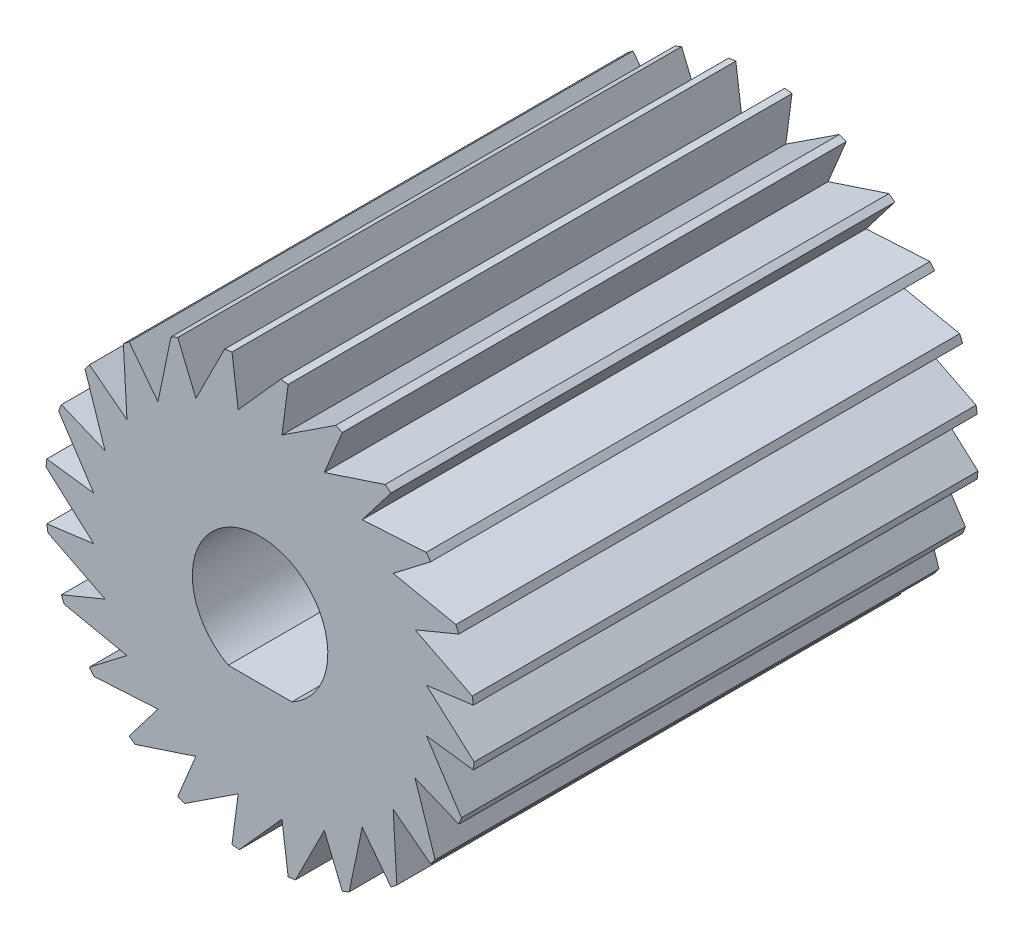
SolidWorks part; units mm, degrees
ref_plane "Front" through (0, 0, 0) normal (0, 0, 1) x (1, 0, 0)
ref_plane "Top" through (0, 0, 0) normal (0, 1, 0) x (1, 0, 0)
ref_plane "Right" through (0, 0, 0) normal (1, 0, 0) x (0, 0, -1)
sketch "Sketch1" plane through (0, 0, 0) normal (0, 0, 1) x (1, 0, 0)
  line L0 (-304.8, 0) -> (304.8, 0) construction
  circle A0 centre (0, 0) radius 12.7 construction
  circle A1 centre (0, 0) radius 13.335 construction
  circle A2 centre (0, 0) radius 4.7625
  circle A3 centre (0, 0) radius 9.906
  point P8 (0, 12.7)
  point P9 (0, -12.7)
extrude "Boss-Extrude1" add sketch "Sketch1" against normal blind 6.35
sketch "Sketch2" plane through (0, 0, 0) normal (0, 0, 1) x (1, 0, 0)
  line L0 (0, 0) -> (0, 12.7) construction
  line L1 (0, 0) -> (-1.293, 9.8213) construction
  line L2 (0, 0) -> (1.7406, 13.2209) construction
  line L3 (-1.293, 9.8213) -> (1.293, 9.8213) construction
  line L4 (-1.293, 9.8213) -> (1.7406, 13.2209)
  line L5 (1.7406, 13.2209) -> (1.293, 9.8213)
  circle A0 centre (0, 0) radius 12.7 construction
  circle A1 centre (0, 0) radius 13.335 construction
  circle A2 centre (0, 0) radius 9.906 construction
  arc A4 (1.293, 9.8213) -> (-1.293, 9.8213) centre (0, 0) ccw
  point P11 (0, 9.8213)
extrude "Boss-Extrude2" add sketch "Sketch2" against normal blind 6.35
pattern_circular "CirPattern1" count 24 over 360 about axis through (0, 0, 0) along (0, 0, 1) of "Boss-Extrude2"
chamfer "Chamfer1" distance 0.0953 angle 45 2 edges at (4.7625, 0, -6.35) (4.7625, 0, 0)
sketch "Pawl" plane through (0, 0, 0) normal (0, 0, 1) x (1, 0, 0)
  line L0 (1.6577, 12.5913) -> (4.4531, 11.8937) construction
  line L1 (1.293, 9.8213) -> (1.7406, 13.2209) construction
  line L2 (5.1031, 12.3199) -> (1.293, 9.8213) construction
  circle A0 centre (0, 0) radius 12.7 construction
  point P4 (3.0554, 12.2425)
  line B0 (3.0554, 13.0045) -> (3.0554, 12.2425)
  circle B1 centre (19.7242, 13.0363) radius 1.1906
  arc B2 (19.0678, 10.7473) -> (19.7242, 15.4175) centre (19.7242, 13.0363) ccw
  arc B3 (8.0376, 15.4175) -> (3.0554, 13.0045) centre (8.0376, 9.0675) ccw
  arc B4 (10.6187, 13.17) -> (3.8174, 12.2425) centre (7.9399, 7.4127) ccw
sketch_block_instance "Block1-1"
sketch_block "Block1"
sketch "Ref" plane through (0, 0, 0) normal (1, 0, 0) x (0, 0, -1)
  line L0 (0.0952, 4.7625) -> (6.2548, 4.7625) construction
  line L1 (6.2548, 4.7625) -> (6.35, 4.8578) construction
  line L2 (0.0952, 4.7625) -> (0, 4.8577) construction
  line L3 (0, -5.9543) -> (0.0952, -4.7625) construction
  line L4 (0, -8.1178) -> (0, -3.7909) construction
  line L5 (0.0952, -4.7625) -> (6.2548, -4.7625) construction
  line L6 (6.2548, -4.7625) -> (6.35, -4.8578) construction
sketch "Sketch3" plane through (0, 0, 0) normal (0, 0, 1) x (1, 0, 0)
  circle A0 centre (0, 0) radius 12.7 construction
  circle A1 centre (0, 0) radius 12.7
extrude "Cut-Extrude-Thin1" cut sketch "Sketch3" against normal through all flip side to cut thin
scale "Scale1" scale about centroid uniform scaling yes scale factor 0.4
sketch "Sketch4" plane through (0, 0, -1.905) normal (0, 0, 1) x (1, 0, 0)
  circle A0 centre (0, 0) radius 2.3829
extrude "Boss-Extrude3" add sketch "Sketch4" against normal up to surface (2.54 mm away)
sketch "Sketch6" plane through (0, 0, -1.905) normal (0, 0, 1) x (1, 0, 0)
  line L48 (3.9285, 0.5172) -> (5.0365, 0.6631)
  line L49 (5.0107, 0.8361) -> (3.6608, 1.5163)
  line L50 (3.6608, 1.5163) -> (4.6933, 1.944)
  line L51 (4.6236, 2.1045) -> (3.1436, 2.4122)
  line L52 (3.1436, 2.4122) -> (4.0302, 3.0925)
  line L53 (3.9213, 3.2295) -> (2.4122, 3.1436)
  line L54 (2.4122, 3.1436) -> (3.0925, 4.0302)
  line L55 (2.9519, 4.1343) -> (1.5163, 3.6608)
  line L56 (1.5163, 3.6608) -> (1.944, 4.6933)
  line L57 (1.7812, 4.7575) -> (0.5172, 3.9285)
  line L58 (0.5172, 3.9285) -> (0.6631, 5.0365)
  line L59 (0.4892, 5.0564) -> (-0.5172, 3.9285)
  line L60 (-0.5172, 3.9285) -> (-0.6631, 5.0365)
  line L61 (-0.8361, 5.0107) -> (-1.5163, 3.6608)
  line L62 (-1.5163, 3.6608) -> (-1.944, 4.6933)
  line L63 (-2.1045, 4.6236) -> (-2.4122, 3.1436)
  line L64 (-2.4122, 3.1436) -> (-3.0925, 4.0302)
  line L65 (-3.2295, 3.9213) -> (-3.1436, 2.4122)
  line L66 (-3.1436, 2.4122) -> (-4.0302, 3.0925)
  line L67 (-4.1343, 2.9519) -> (-3.6608, 1.5163)
  line L68 (-3.6608, 1.5163) -> (-4.6933, 1.944)
  line L69 (-4.7575, 1.7812) -> (-3.9285, 0.5172)
  line L70 (-3.9285, 0.5172) -> (-5.0365, 0.6631)
  line L71 (-5.0564, 0.4892) -> (-3.9285, -0.5172)
  line L72 (-3.9285, -0.5172) -> (-5.0365, -0.6631)
  line L73 (-5.0107, -0.8361) -> (-3.6608, -1.5163)
  line L74 (-3.6608, -1.5163) -> (-4.6933, -1.944)
  line L75 (-4.6236, -2.1045) -> (-3.1436, -2.4122)
  line L76 (-3.1436, -2.4122) -> (-4.0302, -3.0925)
  line L77 (-3.9213, -3.2295) -> (-2.4122, -3.1436)
  line L78 (-2.4122, -3.1436) -> (-3.0925, -4.0302)
  line L79 (-2.9519, -4.1343) -> (-1.5163, -3.6608)
  line L80 (-1.5163, -3.6608) -> (-1.944, -4.6933)
  line L81 (-1.7812, -4.7575) -> (-0.5172, -3.9285)
  line L82 (-0.5172, -3.9285) -> (-0.6631, -5.0365)
  line L83 (-0.4892, -5.0564) -> (0.5172, -3.9285)
  line L84 (0.5172, -3.9285) -> (0.6631, -5.0365)
  line L85 (0.8361, -5.0107) -> (1.5163, -3.6608)
  line L86 (1.5163, -3.6608) -> (1.944, -4.6933)
  line L87 (2.1045, -4.6236) -> (2.4122, -3.1436)
  line L88 (2.4122, -3.1436) -> (3.0925, -4.0302)
  line L89 (3.2295, -3.9213) -> (3.1436, -2.4122)
  line L90 (3.1436, -2.4122) -> (4.0302, -3.0925)
  line L91 (4.1343, -2.9519) -> (3.6608, -1.5163)
  line L92 (3.6608, -1.5163) -> (4.6933, -1.944)
  line L93 (4.7575, -1.7812) -> (3.9285, -0.5172)
  line L94 (3.9285, -0.5172) -> (5.0365, -0.6631)
  line L95 (5.0564, -0.4892) -> (3.9285, 0.5172)
  line L96 (3.9285, 0.5172) -> (5.0365, 0.6631)
  line L97 (5.0107, 0.8361) -> (3.6608, 1.5163)
  line L98 (3.6608, 1.5163) -> (4.6933, 1.944)
  line L99 (4.6236, 2.1045) -> (3.1436, 2.4122)
  line L100 (3.1436, 2.4122) -> (4.0302, 3.0925)
  line L101 (3.9213, 3.2295) -> (2.4122, 3.1436)
  line L102 (2.4122, 3.1436) -> (3.0925, 4.0302)
  line L103 (2.9519, 4.1343) -> (1.5163, 3.6608)
  line L104 (1.5163, 3.6608) -> (1.944, 4.6933)
  line L105 (1.7812, 4.7575) -> (0.5172, 3.9285)
  line L106 (0.5172, 3.9285) -> (0.6631, 5.0365)
  line L107 (0.4892, 5.0564) -> (-0.5172, 3.9285)
  line L108 (-0.5172, 3.9285) -> (-0.6631, 5.0365)
  line L109 (-0.8361, 5.0107) -> (-1.5163, 3.6608)
  line L110 (-1.5163, 3.6608) -> (-1.944, 4.6933)
  line L111 (-2.1045, 4.6236) -> (-2.4122, 3.1436)
  line L112 (-2.4122, 3.1436) -> (-3.0925, 4.0302)
  line L113 (-3.2295, 3.9213) -> (-3.1436, 2.4122)
  line L114 (-3.1436, 2.4122) -> (-4.0302, 3.0925)
  line L115 (-4.1343, 2.9519) -> (-3.6608, 1.5163)
  line L116 (-3.6608, 1.5163) -> (-4.6933, 1.944)
  line L117 (-4.7575, 1.7812) -> (-3.9285, 0.5172)
  line L118 (-3.9285, 0.5172) -> (-5.0365, 0.6631)
  line L119 (-5.0564, 0.4892) -> (-3.9285, -0.5172)
  line L120 (-3.9285, -0.5172) -> (-5.0365, -0.6631)
  line L121 (-5.0107, -0.8361) -> (-3.6608, -1.5163)
  line L122 (-3.6608, -1.5163) -> (-4.6933, -1.944)
  line L123 (-4.6236, -2.1045) -> (-3.1436, -2.4122)
  line L124 (-3.1436, -2.4122) -> (-4.0302, -3.0925)
  line L125 (-3.9213, -3.2295) -> (-2.4122, -3.1436)
  line L126 (-2.4122, -3.1436) -> (-3.0925, -4.0302)
  line L127 (-2.9519, -4.1343) -> (-1.5163, -3.6608)
  line L128 (-1.5163, -3.6608) -> (-1.944, -4.6933)
  line L129 (-1.7812, -4.7575) -> (-0.5172, -3.9285)
  line L130 (-0.5172, -3.9285) -> (-0.6631, -5.0365)
  line L131 (-0.4892, -5.0564) -> (0.5172, -3.9285)
  line L132 (0.5172, -3.9285) -> (0.6631, -5.0365)
  line L133 (0.8361, -5.0107) -> (1.5163, -3.6608)
  line L134 (1.5163, -3.6608) -> (1.944, -4.6933)
  line L135 (2.1045, -4.6236) -> (2.4122, -3.1436)
  line L136 (2.4122, -3.1436) -> (3.0925, -4.0302)
  line L137 (3.2295, -3.9213) -> (3.1436, -2.4122)
  line L138 (3.1436, -2.4122) -> (4.0302, -3.0925)
  line L139 (4.1343, -2.9519) -> (3.6608, -1.5163)
  line L140 (3.6608, -1.5163) -> (4.6933, -1.944)
  line L141 (4.7575, -1.7812) -> (3.9285, -0.5172)
  line L142 (3.9285, -0.5172) -> (5.0365, -0.6631)
  line L143 (5.0564, -0.4892) -> (3.9285, 0.5172)
  arc A24 (5.0365, 0.6631) -> (5.0107, 0.8361) centre (0, 0) ccw
  arc A25 (4.6933, 1.944) -> (4.6236, 2.1045) centre (0, 0) ccw
  arc A26 (4.0302, 3.0925) -> (3.9213, 3.2295) centre (0, 0) ccw
  arc A27 (3.0925, 4.0302) -> (2.9519, 4.1343) centre (0, 0) ccw
  arc A28 (1.944, 4.6933) -> (1.7812, 4.7575) centre (0, 0) ccw
  arc A29 (0.6631, 5.0365) -> (0.4892, 5.0564) centre (0, 0) ccw
  arc A30 (-0.6631, 5.0365) -> (-0.8361, 5.0107) centre (0, 0) ccw
  arc A31 (-1.944, 4.6933) -> (-2.1045, 4.6236) centre (0, 0) ccw
  arc A32 (-3.0925, 4.0302) -> (-3.2295, 3.9213) centre (0, 0) ccw
  arc A33 (-4.0302, 3.0925) -> (-4.1343, 2.9519) centre (0, 0) ccw
  arc A34 (-4.6933, 1.944) -> (-4.7575, 1.7812) centre (0, 0) ccw
  arc A35 (-5.0365, 0.6631) -> (-5.0564, 0.4892) centre (0, 0) ccw
  arc A36 (-5.0365, -0.6631) -> (-5.0107, -0.8361) centre (0, 0) ccw
  arc A37 (-4.6933, -1.944) -> (-4.6236, -2.1045) centre (0, 0) ccw
  arc A38 (-4.0302, -3.0925) -> (-3.9213, -3.2295) centre (0, 0) ccw
  arc A39 (-3.0925, -4.0302) -> (-2.9519, -4.1343) centre (0, 0) ccw
  arc A40 (-1.944, -4.6933) -> (-1.7812, -4.7575) centre (0, 0) ccw
  arc A41 (-0.6631, -5.0365) -> (-0.4892, -5.0564) centre (0, 0) ccw
  arc A42 (0.6631, -5.0365) -> (0.8361, -5.0107) centre (0, 0) ccw
  arc A43 (1.944, -4.6933) -> (2.1045, -4.6236) centre (0, 0) ccw
  arc A44 (3.0925, -4.0302) -> (3.2295, -3.9213) centre (0, 0) ccw
  arc A45 (4.0302, -3.0925) -> (4.1343, -2.9519) centre (0, 0) ccw
  arc A46 (4.6933, -1.944) -> (4.7575, -1.7812) centre (0, 0) ccw
  arc A47 (5.0365, -0.6631) -> (5.0564, -0.4892) centre (0, 0) ccw
  arc A48 (5.0365, 0.6631) -> (5.0107, 0.8361) centre (0, 0) ccw
  arc A49 (4.6933, 1.944) -> (4.6236, 2.1045) centre (0, 0) ccw
  arc A50 (4.0302, 3.0925) -> (3.9213, 3.2295) centre (0, 0) ccw
  arc A51 (3.0925, 4.0302) -> (2.9519, 4.1343) centre (0, 0) ccw
  arc A52 (1.944, 4.6933) -> (1.7812, 4.7575) centre (0, 0) ccw
  arc A53 (0.6631, 5.0365) -> (0.4892, 5.0564) centre (0, 0) ccw
  arc A54 (-0.6631, 5.0365) -> (-0.8361, 5.0107) centre (0, 0) ccw
  arc A55 (-1.944, 4.6933) -> (-2.1045, 4.6236) centre (0, 0) ccw
  arc A56 (-3.0925, 4.0302) -> (-3.2295, 3.9213) centre (0, 0) ccw
  arc A57 (-4.0302, 3.0925) -> (-4.1343, 2.9519) centre (0, 0) ccw
  arc A58 (-4.6933, 1.944) -> (-4.7575, 1.7812) centre (0, 0) ccw
  arc A59 (-5.0365, 0.6631) -> (-5.0564, 0.4892) centre (0, 0) ccw
  arc A60 (-5.0365, -0.6631) -> (-5.0107, -0.8361) centre (0, 0) ccw
  arc A61 (-4.6933, -1.944) -> (-4.6236, -2.1045) centre (0, 0) ccw
  arc A62 (-4.0302, -3.0925) -> (-3.9213, -3.2295) centre (0, 0) ccw
  arc A63 (-3.0925, -4.0302) -> (-2.9519, -4.1343) centre (0, 0) ccw
  arc A64 (-1.944, -4.6933) -> (-1.7812, -4.7575) centre (0, 0) ccw
  arc A65 (-0.6631, -5.0365) -> (-0.4892, -5.0564) centre (0, 0) ccw
  arc A66 (0.6631, -5.0365) -> (0.8361, -5.0107) centre (0, 0) ccw
  arc A67 (1.944, -4.6933) -> (2.1045, -4.6236) centre (0, 0) ccw
  arc A68 (3.0925, -4.0302) -> (3.2295, -3.9213) centre (0, 0) ccw
  arc A69 (4.0302, -3.0925) -> (4.1343, -2.9519) centre (0, 0) ccw
  arc A70 (4.6933, -1.944) -> (4.7575, -1.7812) centre (0, 0) ccw
  arc A71 (5.0365, -0.6631) -> (5.0564, -0.4892) centre (0, 0) ccw
  dimension "D1" = 0
extrude "Boss-Extrude4" add sketch "Sketch6" against normal blind 11.9
sketch "Sketch5" plane through (0, 0, -1.905) normal (0, 0, 1) x (1, 0, 0)
  line L0 (0.75, -1.4133) -> (-0.75, -1.4133)
  circle A0 centre (0, 0) radius 1.6
  dimension "D1" = 3.2
  dimension "D2" = 1.5
extrude "Cut-Extrude1" cut sketch "Sketch5" against normal through all contours L0 A0
equation "\"D1@Sketch2\" = 360/\"Teeth@Sketch1\""
equation "\"D1@Boss-Extrude2\" = \"D1@Boss-Extrude1\""
equation "\"D1@CirPattern1\" = \"Teeth@Sketch1\""
equation "\"D1@Chamfer1\" = \"Bore Dia.@Sketch1\"*.01"
equation "\"D1@Sketch1\"=\"OD@Sketch1\"-.22"
equation "\"D2@Sketch1\"=\"OD@Sketch1\"+.05"
